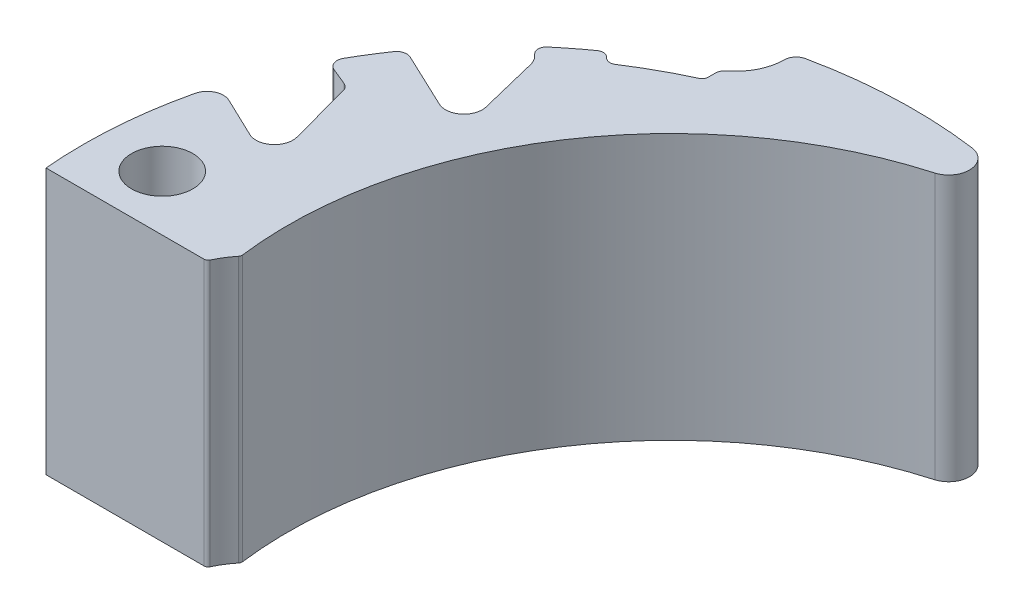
SolidWorks part; units mm, degrees
ref_plane "前视基准面" through (0, 0, 0) normal (0, 0, 1) x (1, 0, 0)
ref_plane "上视基准面" through (0, 0, 0) normal (0, 1, 0) x (1, 0, 0)
ref_plane "右视基准面" through (0, 0, 0) normal (1, 0, 0) x (0, 0, -1)
sketch "Sketch1" plane through (0, 0, 0) normal (0, 1, 0) x (1, 0, 0)
  line L0 (114.1074, 136.0607) -> (126.1074, 136.0607) construction
  line L1 (119.2357, 146.1387) -> (121.2033, 145.1975)
  line L2 (121.6276, 149.3381) -> (122.4607, 146.2434)
  line L3 (121.8351, 152.406) -> (124.552, 151.1214)
  line L4 (125.1027, 155.0306) -> (125.8107, 152.1499)
  line L5 (124.7424, 155.5954) -> (124.8387, 155.499)
  line L6 (120.5074, 150.0093) -> (121.3342, 149.6708)
  line L8 (125.3662, 138.7955) -> (117.6285, 138.7955)
  line L9 (126.6628, 157.1923) -> (126.667, 157.1876)
  line L10 (129.9838, 158.8392) -> (129.9838, 159.1737)
  line L12 (128.0805, 162.3375) -> (128.8236, 160.8139)
  arc A7 (125.1027, 155.0306) -> (124.8387, 155.499) centre (124.1316, 154.7919) ccw
  arc A8 (122.4607, 146.2434) -> (121.2033, 145.1975) centre (121.5916, 146.0094) cw
  arc A9 (125.8107, 152.1499) -> (124.552, 151.1214) centre (124.9367, 151.9351) cw
  arc A13 (130.1793, 159.5703) -> (131.1091, 161.4408) centre (128.7318, 161.4561) ccw
  arc A14 (119.2357, 146.1387) -> (118.1117, 145.6001) centre (118.8905, 145.417) ccw
  arc A16 (121.6276, 149.3381) -> (121.3342, 149.6708) centre (121.1447, 149.2081) ccw
  arc A17 (121.2093, 152.2372) -> (120.2613, 150.7177) centre (137.8988, 140.7689) ccw
  arc A18 (120.5074, 150.0093) -> (120.2613, 150.7177) centre (120.6968, 150.4721) cw
  arc A19 (121.8351, 152.406) -> (121.2093, 152.2372) centre (121.6214, 151.954) ccw
  arc A20 (126.1332, 157.2501) -> (124.7658, 156.1827) centre (137.8988, 140.7689) ccw
  arc A22 (126.1332, 157.2501) -> (126.6628, 157.1923) centre (126.3656, 156.9246) cw
  arc A23 (124.7658, 156.1827) -> (124.7424, 155.5954) centre (125.0252, 155.8782) ccw
  arc A24 (127.1835, 157.1207) -> (126.667, 157.1876) centre (126.9642, 157.4553) cw
  arc A25 (129.8079, 158.5661) -> (127.1835, 157.1207) centre (137.8988, 140.7689) ccw
  arc A26 (130.1793, 159.5703) -> (129.9838, 159.1737) centre (130.4838, 159.1737) ccw
  arc A28 (139.4323, 162.3024) -> (131.5698, 162.0065) centre (136.3488, 139.6261) ccw
  arc A29 (129.9838, 158.8392) -> (129.8079, 158.5661) centre (129.6838, 158.8392) cw
  arc A31 (118.1117, 145.6001) -> (117.6285, 138.7955) centre (138.9486, 140.7009) ccw
  arc A32 (139.5945, 160.3277) -> (126.1249, 139.917) centre (144.7237, 142.2929) ccw
  arc A35 (126.0816, 139.7653) -> (125.5477, 138.9114) centre (129.2223, 137.2078) ccw
  arc A36 (126.1249, 139.917) -> (126.0816, 139.7653) centre (125.9265, 139.8916) cw
  arc A37 (125.5477, 138.9114) -> (125.3662, 138.7955) centre (125.3662, 138.9955) cw
  arc A38 (131.5698, 162.0065) -> (131.1091, 161.4408) centre (131.6914, 161.437) ccw
  arc A39 (139.5538, 160.3161) -> (139.4323, 162.3024) centre (139.2956, 161.2972) ccw
  point P67 (125.4961, 138.7955)
  dimension "D2" = 1
  dimension "D3" = 0.9
  dimension "D4" = 0.9
  dimension "D5" = 0.8
  dimension "D7" = 0.5
  dimension "D8" = 0.5
  dimension "D9" = 0.5
  dimension "D10" = 0.4
  dimension "D11" = 0.4
  dimension "D12" = 0.5
  dimension "D13" = 0.3
  dimension "D14" = 0.2
  dimension "D15" = 0.2
  dimension "D1" = 12
extrude "Boss-Extrude1" add sketch "Sketch1" along normal blind 13
sketch "Sketch2" plane through (0, 13, 0) normal (0, 1, 0) x (1, 0, 0)
  arc A0 (126.1249, 139.917) -> (139.5945, 160.3277) centre (144.7237, 142.2929) cw construction
  arc A2 (139.5945, 160.3277) -> (126.1249, 139.917) centre (144.7237, 142.2929) ccw construction
  circle A3 centre (144.7237, 142.2929) radius 18.75
  dimension "D1" = 37.5
sketch "Schizzo2" plane through (0, 0, 0) normal (0, 1, 0) x (1, 0, 0)
  line L0 (120.6102, 141.5) -> (120.6102, 137.4828) construction
  point P0 (120.6102, 141.5)
ref_plane "Piano1" through (120.6102, 0, -141.5) normal (0, 0, 1) x (1, 0, 0)
sketch "Schizzo3" plane through (0, 0, -141.5) normal (0, 0, 1) x (1, 0, 0)
  line L0 (120.6102, 0) -> (120.6102, -5.7979) construction
  line L1 (116.1968, 6.5) -> (124.2, 6.5) construction
  line L2 (119.1102, 13) -> (120.6102, 13)
  line L3 (119.1102, 13) -> (119.1102, 8.5)
  line L6 (119.1102, 8.5) -> (119.8602, 8)
  line L7 (120.6102, 0) -> (120.6102, 13) construction
  line L12 (125.3662, 13) -> (117.6285, 13) construction
  line L13 (119.1102, 4.5) -> (119.8602, 5)
  line L14 (119.1102, 0) -> (119.1102, 4.5)
  line L15 (119.1102, 0) -> (120.6102, 0)
  line L16 (119.8602, 8) -> (119.8602, 5)
  line L17 (120.6102, 13) -> (120.6102, 0)
  dimension "D2" = 1.5
  dimension "D3" = 0
  dimension "D4" = 5
  dimension "D5" = 0.75
  dimension "D6" = 4.5
revolve "Taglia-Rivoluzione1" cut sketch "Schizzo3" angle 360 about L17
